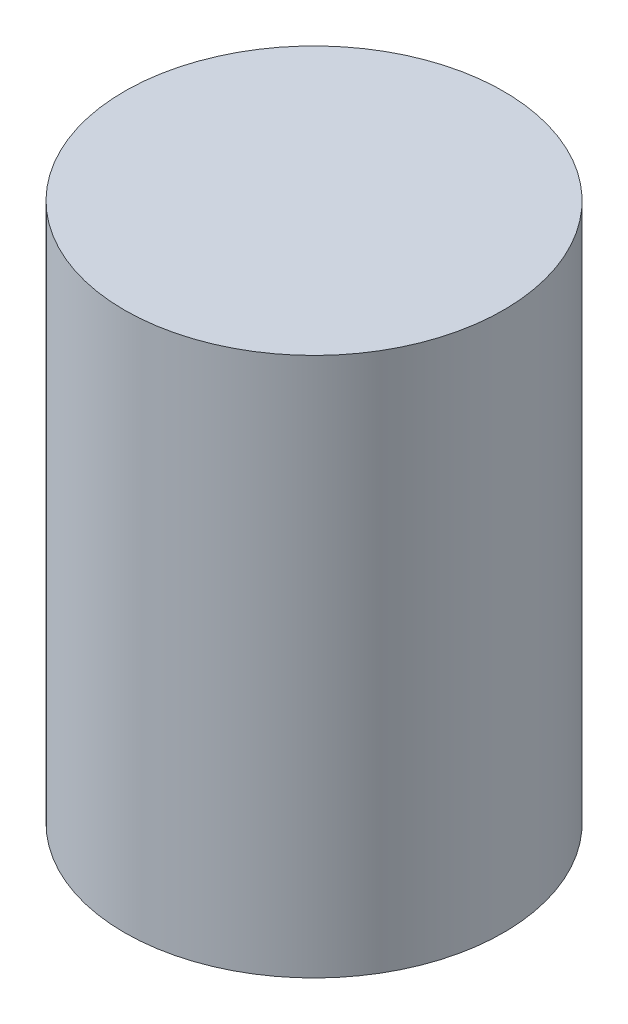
SolidWorks part; units mm, degrees
ref_plane "Front" through (0, 0, 0) normal (0, 0, 1) x (1, 0, 0)
ref_plane "Top" through (0, 0, 0) normal (0, 1, 0) x (1, 0, 0)
ref_plane "Right" through (0, 0, 0) normal (1, 0, 0) x (0, 0, -1)
sketch "Sketch1"
  dimension "D1" = 45
extrude "Extrude1" add sketch "Sketch1" along normal blind 64
